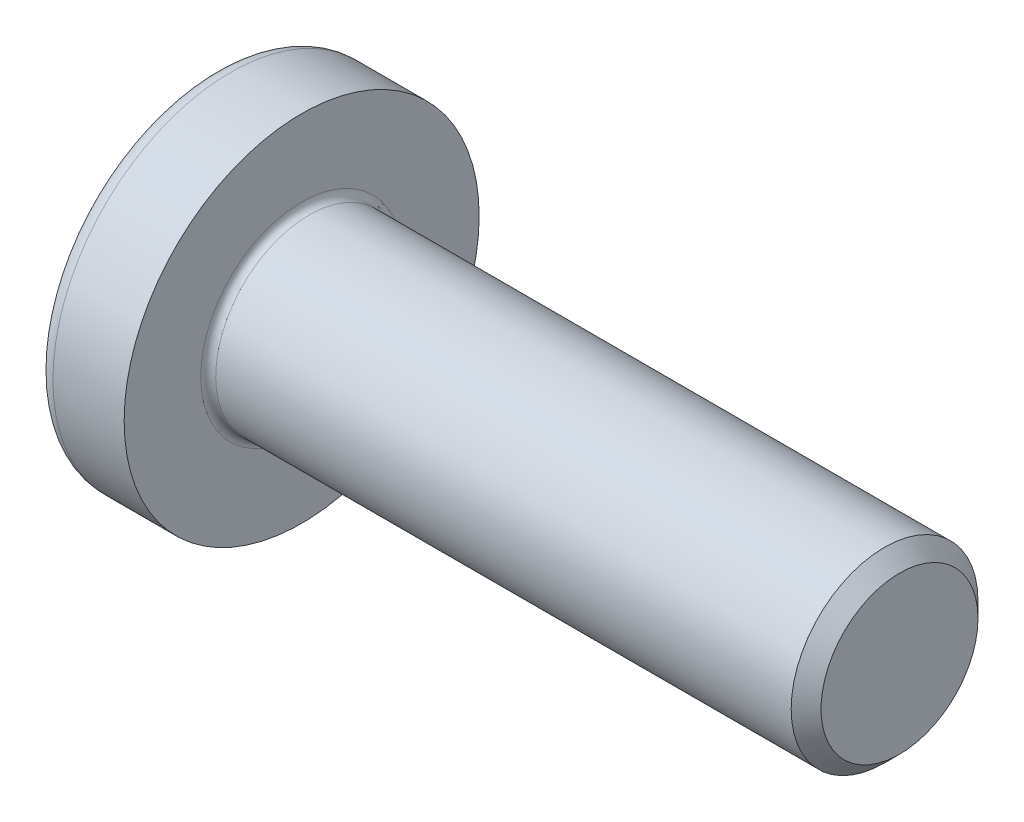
SolidWorks part; units mm, degrees
ref_plane "Plane1" through (0, 0, 0) normal (0, 0, 1) x (1, 0, 0)
ref_plane "Plane2" through (0, 0, 0) normal (0, 1, 0) x (1, 0, 0)
ref_plane "Plane3" through (0, 0, 0) normal (1, 0, 0) x (0, 0, -1)
revolve "Base-Revolve" add sketch "BodySke"
sketch "BodySke" plane through (0, 0, 0) normal (0, 0, 1) x (1, 0, 0)
  line L0 (3.7, 2.5) -> (3.7, 4.75)
  line L1 (4.1, 6.35) -> (4.1, -3.175) construction
  line L2 (-25.4, 0) -> (127, 0) construction
  line L3 (19.7, 0) -> (0, 0)
  line L4 (3.7, 2.5) -> (19.7, 2.5)
  line L5 (19.7, 2.5) -> (19.7, 0)
  line L6 (1.7942, 4.75) -> (3.7, 4.75)
  line L8 (3.7, 6.35) -> (3.7, -3.175) construction
  arc A0 (1.4243, 4.5563) -> (0, 0) centre (8, 0) ccw
  arc A2 (1.4243, 4.5563) -> (1.7942, 4.75) centre (1.7942, 4.3) cw
  dimension "Head_fillet_rad" = 0.45
  dimension "Head_crown_rad" = 8
  dimension "Head_ht" = 3.7
  dimension "Diameter" = 5
  dimension "Length" = 16
  dimension "Head_dia" = 9.5
  dimension "Advance" = 0.8
  dimension "Thread_nom" = 16
fillet "Fillet1" radius 0.2 1 edges at (3.7, 0, 2.5)
sketch "Sketch3" plane through (0, 0, 0) normal (1, 0, 0) x (0, 0, -1)
  line L0 (0.515, -2.35) -> (-0.515, -2.35)
  line L1 (0.515, -2.35) -> (0.515, 2.35)
  line L2 (-0.515, 2.35) -> (0.515, 2.35)
  line L3 (-0.515, 2.35) -> (-0.515, -2.35)
  dimension "D1" = 2.35
  dimension "Cross_dia" = 4.7
  dimension "D2" = 0.515
  dimension "Cross_width" = 1.03
ref_plane "Plane4" through (2.74, 0, 0) normal (1, 0, 0) x (0, 0, -1)
sketch "Sketch4" plane through (2.74, 0, 0) normal (1, 0, 0) x (0, 0, -1)
  line L0 (0.515, -0.9839) -> (-0.515, -0.9839)
  line L1 (0.515, -0.9839) -> (0.515, 0.9839)
  line L2 (-0.515, 0.9839) -> (0.515, 0.9839)
  line L3 (-0.515, 0.9839) -> (-0.515, -0.9839)
  dimension "D1" = 1.03
  dimension "D2" = 1.9678
  dimension "D3" = 0.515
  dimension "D4" = 0.9839
loft "Recess" cut profiles "Sketch3", "Sketch4"
pattern_circular "RecPat" count 2 every 90 about axis through (0, 0, 0) along (1, 0, 0) of "Recess"
sketch "RecCorSke" plane through (0, 0, 0) normal (0, 0, 1) x (1, 0, 0)
  line L0 (-3.175, 0) -> (15.875, 0) construction
  line L1 (-25.4, 0) -> (127, 0) construction
  line L2 (0, 0) -> (0, 1.0426)
  line L3 (0, 1.0426) -> (2.74, 0.851)
  line L4 (2.74, 0.851) -> (3.0165, 0)
  line L5 (3.0165, 0) -> (0, 0)
  dimension "Diameter" = 1.702
  dimension "Depth" = 2.74
  dimension "Draft_angle" = 4
  dimension "Bottom_angle" = 18
revolve "RecessCore" cut sketch "RecCorSke" angle 360 about L0
sketch "ThdSchSke" plane through (0, 0, 0) normal (0, 0, 1) x (1, 0, 0)
  line L0 (5.3, -2.055) -> (4.9884, -2.5)
  line L1 (5.3, -2.055) -> (5.6116, -2.5)
  line L2 (5.6116, -2.5) -> (5.6116, -3.125)
  line L3 (-3.175, 0) -> (5.1513, 0) construction
  line L5 (5.6116, -3.125) -> (4.9884, -3.125)
  line L6 (4.9884, -3.125) -> (4.9884, -2.5)
  dimension "Thread_minor" = 4.11
  dimension "Diameter" = 5
  dimension "Start" = 5.3
  dimension "SideAngle" = 55
  dimension "VeeAngle" = 70
  dimension "Overcut" = 6.25
revolve "ThreadSchematic" [suppressed] cut sketch "ThdSchSke" angle 360 about L3
pattern_linear "ThdSchPat" [suppressed]
chamfer "Chanfrein1" distance 0.4 angle 45 1 edges at (19.7, 0, 2.5)
equation "\"D1@Sketch3\" = \"Cross_dia@Sketch3\" / 2"
equation "\"D2@Sketch3\" = \"Cross_width@Sketch3\" / 2"
equation "\"Depth@RecCorSke\" = \"Cross_depth@Plane4\""
equation "\"D1@Sketch4\" = \"Cross_width@Sketch3\""
equation "\"D2@Sketch4\" = \"Cross_dia@Sketch3\" - 2.0 * \"Cross_depth@Plane4\" * tan(26.5  * 0.017453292)"
equation "\"D3@Sketch4\" = \"D1@Sketch4\" / 2"
equation "\"D4@Sketch4\" = \"D2@Sketch4\" / 2"
equation "\"Thread_length@ThreadCosmetic\" = ((sgn( (\"Length@BodySke\" - \"Advance@BodySke\" * 2.0 ) - \"Thread_nom@BodySke\" )-1)*( (\"Length@BodySke\" - \"Advance@BodySke\" * 2.0 ) - \"Thread_nom@BodySke\" ))/-2+ \"Thread_"
equation "\"Thread_minor@ThdSchSke\" = \"Thread_minor@ThreadCosmetic\""
equation "\"Diameter@ThdSchSke\" = \"Diameter@BodySke\""
equation "\"Overcut@ThdSchSke\" = \"Diameter@BodySke\" * 1.25"
equation "\"Start@ThdSchSke\" = \"Head_ht@BodySke\" + \"Length@BodySke\" - \"Thread_length@ThreadCosmetic\"  '---Non-countersunk---"
equation "\"Num_threads@ThdSchPat\" = int( \"Thread_length@ThreadCosmetic\" / \"Advance@BodySke\" + 0.999 )  + 1"
equation "\"Advance@ThdSchPat\" = \"Thread_length@ThreadCosmetic\" /  (\"Num_threads@ThdSchPat\" - 1) 'relax it"
